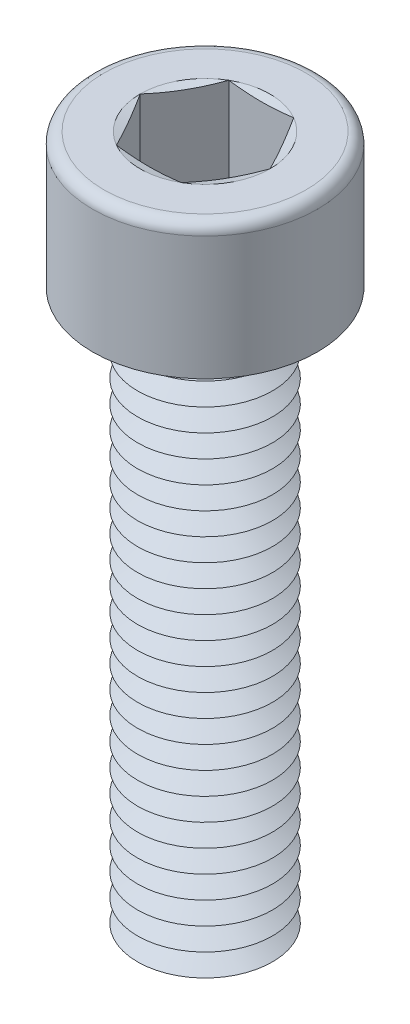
SolidWorks part; units mm, degrees
ref_plane "Front Plane" through (0, 0, 0) normal (0, 0, 1) x (1, 0, 0)
ref_plane "Top Plane" through (0, 0, 0) normal (0, 1, 0) x (1, 0, 0)
ref_plane "Right Plane" through (0, 0, 0) normal (1, 0, 0) x (0, 0, -1)
sketch "Sketch1" plane through (0, 0, 0) normal (0, 1, 0) x (1, 0, 0)
  circle A0 centre (0, 0) radius 3
  dimension "D1" = 6
extrude "Extrude1" add sketch "Sketch1" along normal blind 25
sketch "Sketch2" plane through (0, 25, 0) normal (0, 1, 0) x (1, 0, 0)
  circle A0 centre (0, 0) radius 5
  dimension "D1" = 10
extrude "Extrude2" add sketch "Sketch2" along normal blind 6
sketch "Sketch3" plane through (0, 31, 0) normal (0, 1, 0) x (1, 0, 0)
  line L1 (1.4434, 2.5) -> (-1.4434, 2.5)
  line L2 (-1.4434, 2.5) -> (-2.8868, 0)
  line L3 (-2.8868, 0) -> (-1.4434, -2.5)
  line L4 (-1.4434, -2.5) -> (1.4434, -2.5)
  line L5 (1.4434, -2.5) -> (2.8868, 0)
  line L6 (2.8868, 0) -> (1.4434, 2.5)
  circle A0 centre (0, 0) radius 2.5 construction
  dimension "D1" = 5
extrude "Extrude3" cut sketch "Sketch3" against normal blind 5
fillet "Fillet1" radius 0.5 1 edges at (0, 31, 5)
sketch "Sketch4" plane through (0, 0, 0) normal (1, 0, 0) x (0, 0, -1)
  line L0 (-2.5, 26) -> (0, 26)
  line L1 (0, 26) -> (0, 24.5566)
  line L2 (0, 24.5566) -> (-2.5, 26)
  dimension "D1" = 30
revolve "Cut-Revolve1" cut sketch "Sketch4" angle 360 about L1
sketch "Sketch5" plane through (0, 0, 0) normal (0, 0, 1) x (1, 0, 0)
  line L0 (-3, 0.5) -> (-3, -0.5)
  line L1 (-3, 25) -> (-3, 0) construction
  line L2 (-3, -0.5) -> (-2.134, 0)
  line L3 (-3, 0) -> (3, 0) construction
  line L4 (-2.134, 0) -> (-3, 0.5)
  dimension "D1" = 1
revolve "Cut-Revolve2" cut sketch "Sketch5" angle 360 about axis through (0, 25, 0) along (0, -1, 0)
pattern_linear "LPattern1" count 25 spacing 1 along (0, 1, 0) of "Cut-Revolve2"
sketch "Sketch6" plane through (0, 31, 0) normal (0, 1, 0) x (1, 0, 0)
  circle A0 centre (0, 0) radius 2.8868
extrude "Extrude4" cut sketch "Sketch6" against normal through all draft 75
